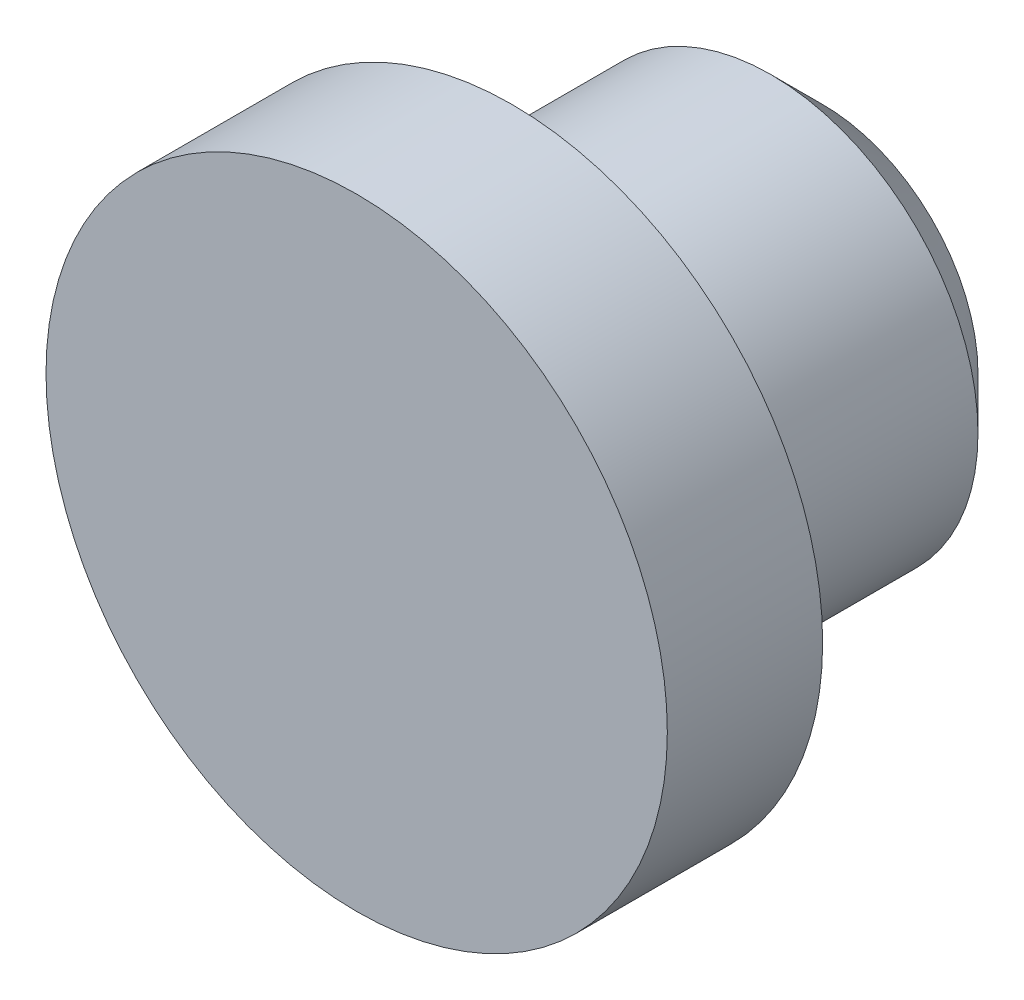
SolidWorks part; units mm, degrees
ref_plane "Plan de face" through (0, 0, 0) normal (0, 0, 1) x (1, 0, 0)
ref_plane "Plan de dessus" through (0, 0, 0) normal (0, 1, 0) x (1, 0, 0)
ref_plane "Plan de droite" through (0, 0, 0) normal (1, 0, 0) x (0, 0, -1)
sketch "Esquisse1" plane through (0, 0, 0) normal (0, 0, 1) x (1, 0, 0)
  circle A0 centre (0, 0) radius 4
  dimension "D1" = 8
extrude "Boss.-Extru.1" add sketch "Esquisse1" along normal blind 6
sketch "Esquisse2" plane through (0, 0, 6) normal (0, 0, 1) x (1, 0, 0)
  circle A0 centre (0, 0) radius 6
  dimension "D1" = 12
extrude "Boss.-Extru.2" add sketch "Esquisse2" along normal blind 3
chamfer "Chanfrein1" distance 1 angle 45 1 edges at (4, 0, 0)
